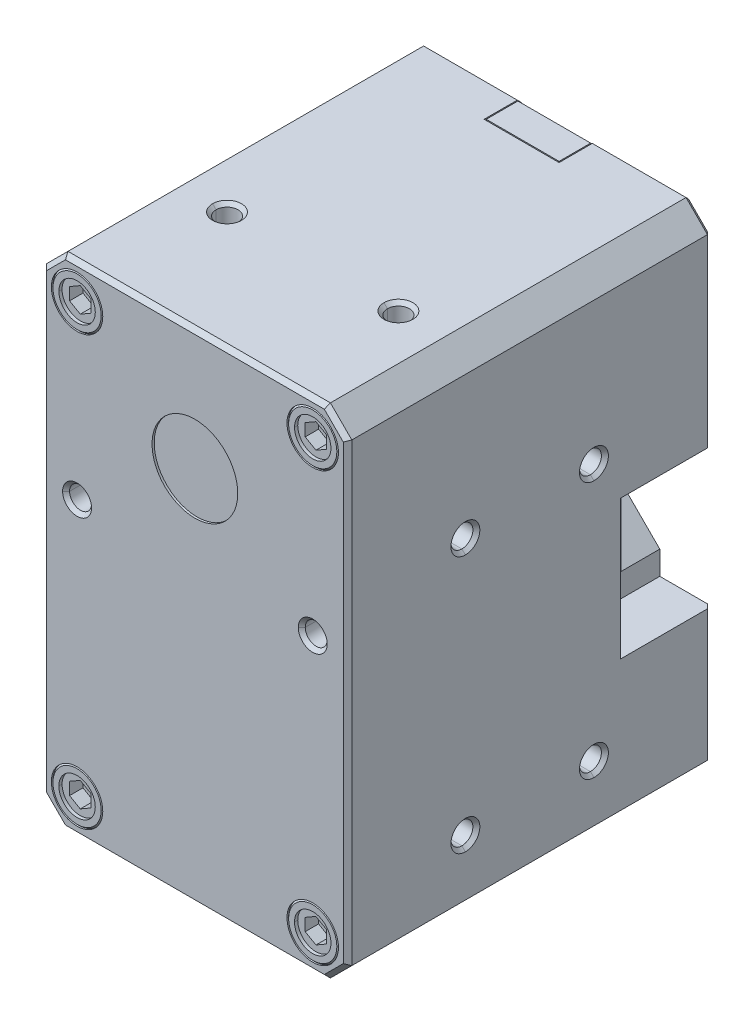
SolidWorks part; units mm, degrees
ref_plane "Front Plane" through (0, 0, 0) normal (0, 0, 1) x (1, 0, 0)
ref_plane "Top Plane" through (0, 0, 0) normal (0, 1, 0) x (1, 0, 0)
ref_plane "Right Plane" through (0, 0, 0) normal (1, 0, 0) x (0, 0, -1)
body saved out of another part "Stock-XM,H-430_idler.stp-1"
sketch "Sketch1" plane through (0, 0, 17) normal (0, 0, 1) x (1, 0, 0)
  circle A0 centre (0, 0) radius 4
  dimension "D1" = 8
extrude "Cut-Extrude1" cut sketch "Sketch1" against normal blind 0.2
